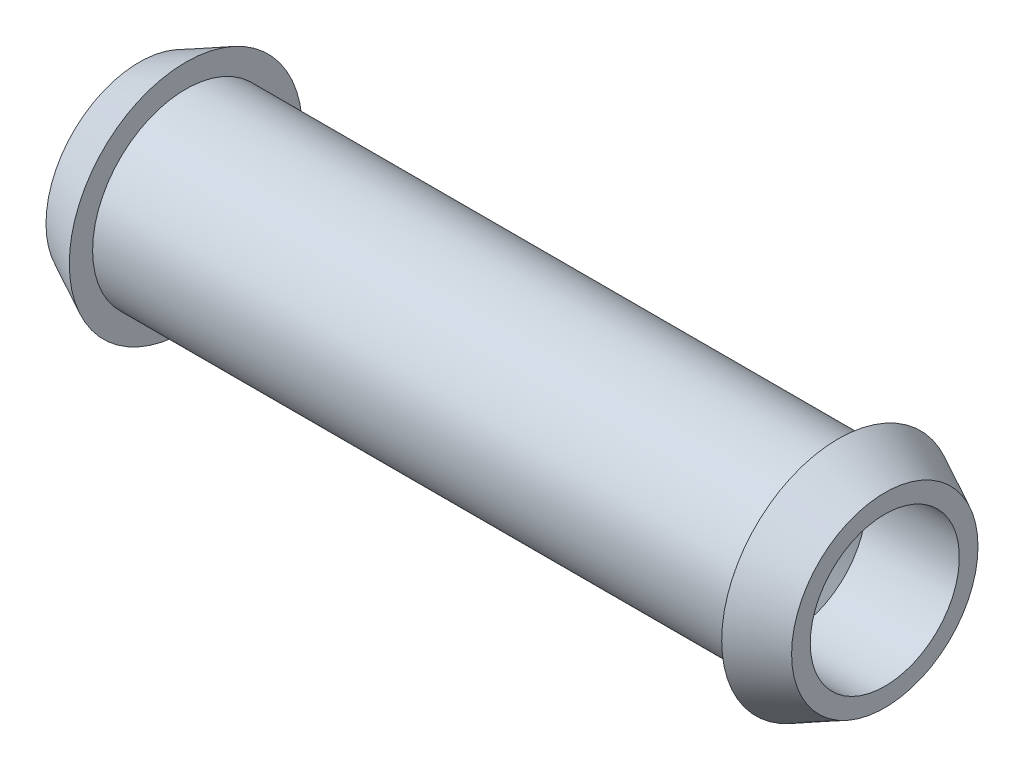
SolidWorks part; units mm, degrees
ref_plane "Plane1" through (0, 0, 0) normal (0, 0, 1) x (1, 0, 0)
ref_plane "Plane2" through (0, 0, 0) normal (0, 1, 0) x (1, 0, 0)
ref_plane "Plane3" through (0, 0, 0) normal (1, 0, 0) x (0, 0, -1)
sketch "Sketch1" plane through (0, 0, 0) normal (0, 0, 1) x (1, 0, 0)
  line L0 (-30, 0) -> (31, 0) construction
  line L2 (-20, 0) -> (20, 0)
  line L3 (-20, 0) -> (-20, 5)
  line L4 (-20, 5) -> (20, 5)
  line L5 (20, 0) -> (20, 5)
  dimension "Length" = 40
  dimension "Diameter" = 10
revolve "Base-Revolve" add sketch "Sketch1" angle 360 about L0
sketch "Sketch2" plane through (0, 0, 0) normal (0, 0, 1) x (1, 0, 0)
  line L0 (-30, 0) -> (30, 0) construction
  line L1 (-30, 0) -> (31, 0) construction
  line L3 (-21, 0) -> (-17.5, 0)
  line L4 (-21, 0) -> (-21, 6)
  line L5 (-21, 6) -> (-17.5, 6)
  line L6 (-17.5, 0) -> (-17.5, 6)
  line L7 (17.5, 0) -> (21, 0)
  line L8 (17.5, 0) -> (17.5, 6)
  line L9 (17.5, 6) -> (21, 6)
  line L10 (21, 0) -> (21, 6)
  dimension "D1" = 17.5
  dimension "GripLength" = 35
  dimension "D2" = 42
  dimension "D3" = 21
  dimension "D4" = 12
revolve "Cut-to-GripLength" cut sketch "Sketch2" angle 360 about L0
sketch "Sketch3" plane through (0, 0, 0) normal (0, 0, 1) x (1, 0, 0)
  line L0 (-23, 0) -> (23, 0) construction
  line L1 (-30, 0) -> (31, 0) construction
  line L2 (-20, 5) -> (-20, 0)
  line L3 (-20, 0) -> (-17.5, 0)
  line L4 (-20, 5) -> (-17.5, 6.25)
  line L5 (-17.5, 6.25) -> (-17.5, 0)
  line L6 (20, 5) -> (17.5, 6.25)
  line L7 (17.5, 6.25) -> (17.5, 0)
  line L10 (20, 5) -> (20, 0)
  line L11 (20, 0) -> (17.5, 0)
  line L12 (-17.5, 5) -> (-17.5, -5) construction
  line L13 (17.5, -5) -> (17.5, 5) construction
  dimension "D1" = 10
  dimension "D2" = 12.5
  dimension "D3" = 2.5
  dimension "HeadHt" = 2.5
revolve "HeadTypeA" add sketch "Sketch3" angle 360 about L0
sketch "Sketch4" plane through (0, 0, 0) normal (0, 0, 1) x (1, 0, 0)
  line L0 (-20, 0) -> (20, 0) construction
  line L1 (-30, 0) -> (31, 0) construction
  line L2 (-17.5, 0) -> (-17.5, 6.25)
  line L3 (-17.5, 6.25) -> (-15.3349, 5)
  line L4 (-15.3349, 0) -> (-17.5, 0)
  line L5 (-17.5, -6.25) -> (-15.3349, -5) construction
  line L6 (0, 0) -> (0, 14) construction
  line L7 (15.3349, 0) -> (17.5, 0)
  line L8 (17.5, 0) -> (17.5, 6.25)
  line L9 (-15.3349, 5) -> (-15.3349, 0)
  line L10 (15.3349, 5) -> (15.3349, 0)
  line L11 (17.5, 6.25) -> (15.3349, 5)
  dimension "D1" = 10
  dimension "D2" = 12.5
  dimension "D3" = 60
  dimension "D4" = 35
revolve "HeadTypeB" [suppressed] add sketch "Sketch4" angle 360 about L0
sketch "Sketch5" plane through (0, 0, 0) normal (0, 0, 1) x (1, 0, 0)
  line L0 (-22, 0) -> (21, 0) construction
  line L1 (-30, 0) -> (31, 0) construction
  line L2 (-12.6906, 0) -> (-15, 4)
  line L4 (-15, 4) -> (-20, 4)
  line L5 (-20, 4) -> (-20, 0)
  line L6 (-20, 0) -> (-12.6906, 0)
  line L7 (12.6906, 0) -> (15, 4)
  line L8 (15, 4) -> (20, 4)
  line L9 (20, 4) -> (20, 0)
  line L10 (20, 0) -> (12.6906, 0)
  line L11 (-12.6906, 0) -> (-15, -4) construction
  line L12 (12.6906, 0) -> (15, -4) construction
  dimension "D1" = 40
  dimension "HoleDia" = 8
  dimension "HoleDepth" = 5
  dimension "D2" = 20
  dimension "D3" = 5
  dimension "D4" = 120
  dimension "D5" = 120
  dimension "D6" = 8
revolve "HoleTypeA" cut sketch "Sketch5" angle 360 about L0
sketch "Sketch6" plane through (0, 0, 0) normal (0, 0, 1) x (1, 0, 0)
  line L0 (-22, 0) -> (22, 0) construction
  line L1 (-30, 0) -> (31, 0) construction
  line L2 (-20, 5) -> (-17.1132, 0)
  line L4 (-17.1132, 0) -> (-20, 0)
  line L5 (-20, 0) -> (-20, 5)
  line L6 (-20, -5) -> (-17.1132, 0) construction
  line L7 (20, -5) -> (17.1132, 0) construction
  line L8 (17.1132, 0) -> (20, 0)
  line L9 (20, 0) -> (20, 5)
  line L10 (20, 5) -> (17.1132, 0)
  dimension "D1" = 120
  dimension "D2" = 10
  dimension "D3" = 120
  dimension "D4" = 40
  dimension "D5" = 20
revolve "HoleTypeB" [suppressed] cut sketch "Sketch6" angle 360 about L0
equation "\"D1@Sketch2\" = \"GripLength@Sketch2\" / 2"
equation "\"D2@Sketch2\" = \"Length@Sketch1\" + 2"
equation "\"D3@Sketch2\" = \"D2@Sketch2\" / 2"
equation "\"D4@Sketch2\" = \"Diameter@sketch1\" + 2"
equation "\"D1@Sketch3\" = \"Diameter@Sketch1\""
equation "\"D2@Sketch3\" = \"Diameter@Sketch1\" * 1.25"
equation "\"D3@Sketch3\" = \"HeadHt@Sketch3\""
equation "\"D1@Sketch5\" = \"Length@Sketch1\""
equation "\"D2@Sketch5\" = \"D1@Sketch5\" / 2"
equation "\"D3@Sketch5\" = \"HoleDepth@Sketch5\""
equation "\"D5@Sketch5\" = \"D4@Sketch5\""
equation "\"D6@Sketch5\" = \"HoleDia@Sketch5\""
equation "\"D2@Sketch6\" = \"Diameter@Sketch1\""
equation "\"D3@Sketch6\" = \"D1@Sketch6\""
equation "\"D4@Sketch6\" = \"Length@Sketch1\""
equation "\"D5@Sketch6\" = \"D4@Sketch6\" / 2"
equation "\"D1@Sketch4\" = \"Diameter@Sketch1\""
equation "\"D2@Sketch4\" = \"Diameter@Sketch1\" * 1.25"
equation "\"D4@Sketch4\" = \"GripLength@Sketch2\""
